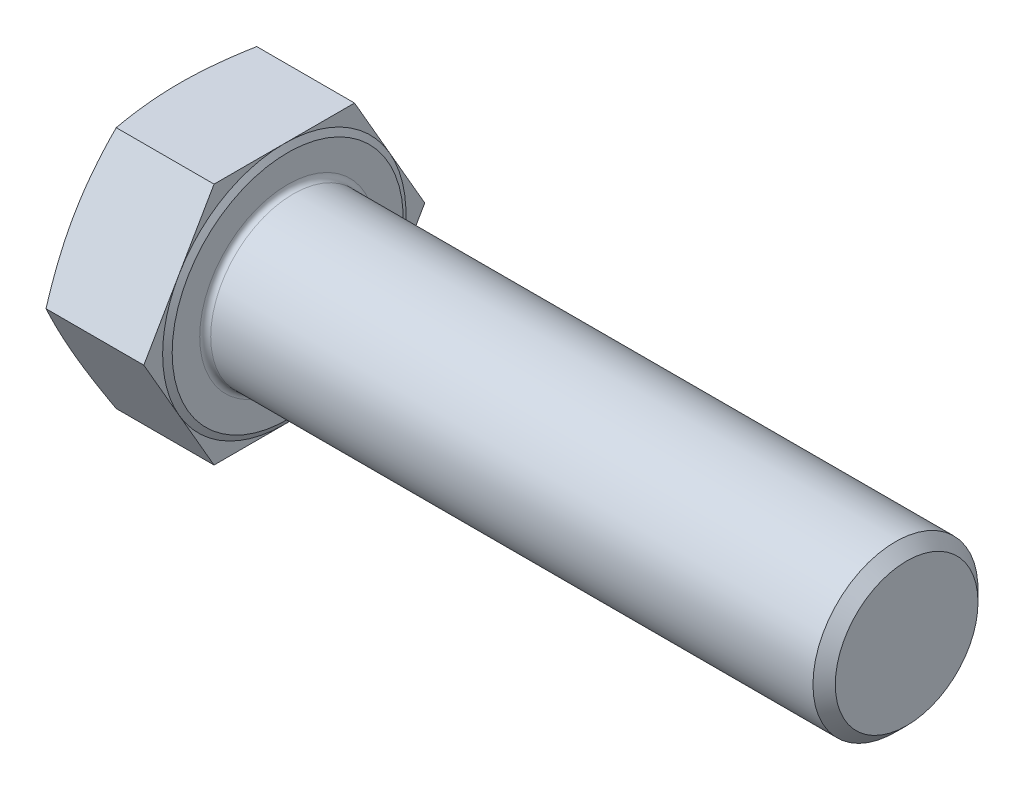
SolidWorks part; units mm, degrees
ref_plane "Front" through (0, 0, 0) normal (0, 0, 1) x (1, 0, 0)
ref_plane "Top" through (0, 0, 0) normal (0, 1, 0) x (1, 0, 0)
ref_plane "Right" through (0, 0, 0) normal (1, 0, 0) x (0, 0, -1)
sketch "Sketch-BaseHead" plane through (0, 0, 0) normal (1, 0, 0) x (0, 0, -1)
  line L1 (20.4267, 0) -> (10.2133, 17.69)
  line L2 (10.2133, 17.69) -> (-10.2133, 17.69)
  line L3 (-10.2133, 17.69) -> (-20.4267, 0)
  line L4 (-20.4267, 0) -> (-10.2133, -17.69)
  line L5 (-10.2133, -17.69) -> (10.2133, -17.69)
  line L6 (10.2133, -17.69) -> (20.4267, 0)
  circle A0 centre (0, 0) radius 17.69 construction
  dimension "s" = 35.38
extrude "BaseHead" add sketch "Sketch-BaseHead" along normal blind 15.22
sketch "Sketch4" plane through (-0.2646, 0, 5.9169) normal (0, 1, 0) x (0, 0, -1)
  line L0 (5.9169, 3.7369) -> (5.9169, -10.4477) construction
  line L2 (26.3435, -0.2646) -> (23.6069, -0.2646)
  line L4 (23.6069, -0.2646) -> (26.3435, -1.2607)
  line L6 (26.3435, -1.2607) -> (26.3435, -0.2646)
  dimension "D1" = 20
  dimension "D2" = 35.38
revolve "HeadChamfer" cut sketch "Sketch4" angle 360 about L0
sketch "Sketch1" plane through (0, 0, 0) normal (0, 0, 1) x (1, 0, 0)
  line L0 (15.22, 0) -> (15.72, 0)
  line L1 (15.72, 0) -> (15.72, -16.805)
  line L2 (15.72, -16.805) -> (15.22, -17.69)
  line L3 (15.22, -17.69) -> (15.22, 0) construction
  line L4 (0, 0) -> (7.5821, 0) construction
  line L5 (-4.0016, 0) -> (10.1831, 0) construction
  line L6 (15.22, -17.69) -> (0.9961, -17.69) construction
  line L7 (15.22, 0) -> (15.22, -17.69)
  dimension "D1" = 17.69
  dimension "c" = 0.5
  dimension "D2" = 16.805
revolve "Revolve1" add sketch "Sketch1" angle 360 about axis through (-4.0016, 0, 0) along (1, 0, 0)
ref_plane "Plane2" through (51.72, 0, 0) normal (1, 0, 0) x (0, 0, -1)
sketch "Sketch3" plane through (15.72, 0, 0) normal (1, 0, 0) x (0, 0, -1)
  circle A0 centre (0, 0) radius 12
  dimension "d" = 24
extrude "BaseBody" add sketch "Sketch3" along normal blind 90
fillet "HeadFillet" radius 0.8 1 edges at (15.72, 0, -12)
chamfer "Chamfer1" distance 1.624 angle 45 1 edges at (105.72, 0, -12)
equation "\"D1@Sketch1\" = \"s@Sketch-BaseHead\"/ 2"
equation "\"D2@Sketch4\" = \"s@Sketch-BaseHead\""
equation "\"D1@Chamfer1\" =  ( \"d@Sketch3\" - \"D2@ThreadCosmetic1\" ) / 2 "
equation "\"b@ThreadCosmetic1\" = \"l@BaseBody\" - \"lg@Plane2\""
